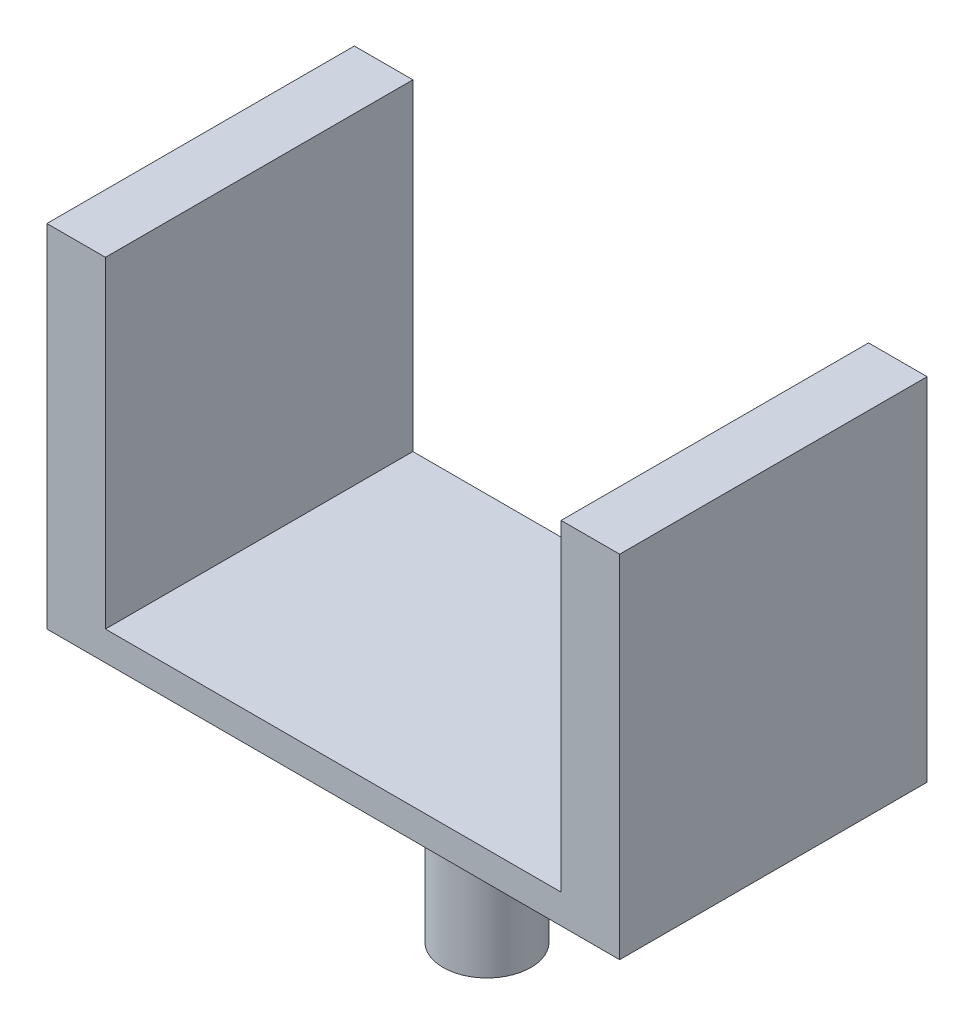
SolidWorks part; units mm, degrees
ref_plane "Front Plane" through (0, 0, 0) normal (0, 0, 1) x (1, 0, 0)
ref_plane "Top Plane" through (0, 0, 0) normal (0, 1, 0) x (1, 0, 0)
ref_plane "Right Plane" through (0, 0, 0) normal (1, 0, 0) x (0, 0, -1)
sketch "Sketch2" plane through (0, 0, 0) normal (0, 1, 0) x (1, 0, 0)
  line L1 (19.57, -10.505) -> (-19.57, -10.505)
  line L2 (19.57, -10.505) -> (19.57, 10.505)
  line L3 (19.57, 10.505) -> (-19.57, 10.505)
  line L4 (-19.57, -10.505) -> (-19.57, 10.505)
  line L5 (19.57, -10.505) -> (-19.57, 10.505) construction
  line L6 (19.57, 10.505) -> (-19.57, -10.505) construction
  point P0 (0, 0)
  dimension "D1" = 39.14
  dimension "D2" = 21.01
extrude "Boss-Extrude1" add sketch "Sketch2" along normal blind 24
sketch "Sketch3" plane through (0, 0, 0) normal (0, 0, 1) x (1, 0, 0)
  line L0 (-19.57, 24) -> (-19.57, 0)
  line L1 (-19.57, 0) -> (19.57, 0)
  line L2 (19.57, 0) -> (19.57, 24)
  line L3 (19.57, 24) -> (15.57, 24)
  line L4 (-19.57, 24) -> (19.57, 24) construction
  line L5 (15.57, 24) -> (15.57, 2)
  line L6 (15.57, 2) -> (-15.57, 2)
  line L7 (-15.57, 2) -> (-15.57, 24)
  line L8 (-15.57, 24) -> (-19.57, 24)
  dimension "D1" = 2
  dimension "D2" = 4
  dimension "D3" = 4
extrude "Cut-Extrude1" cut sketch "Sketch3" against normal blind 24 and the other way blind 24 flip side to cut
sketch "Sketch4" plane through (0, 0, 0) normal (0, 1, 0) x (1, 0, 0)
  circle A0 centre (0, 0) radius 3
  dimension "D1" = 6
extrude "Boss-Extrude2" add sketch "Sketch4" against normal blind 14
